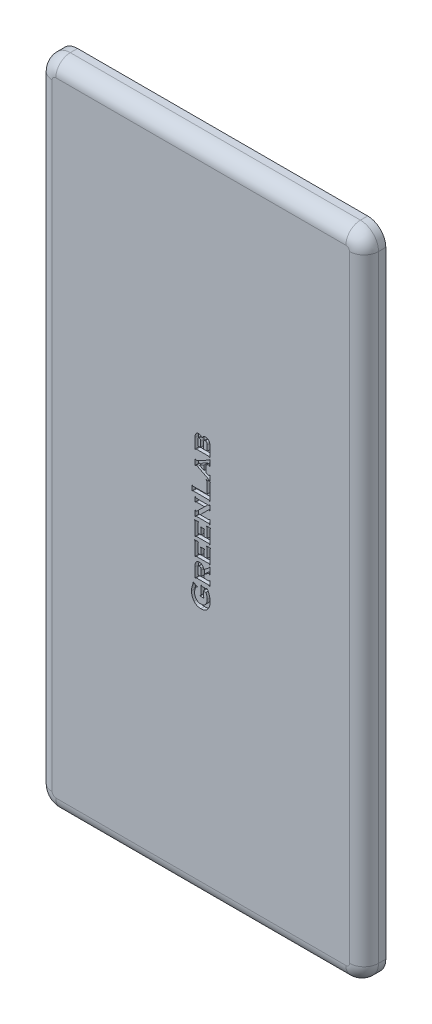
SolidWorks part; units mm, degrees
ref_plane "Front Plane" through (0, 0, 0) normal (0, 0, 1) x (1, 0, 0)
ref_plane "Top Plane" through (0, 0, 0) normal (0, 1, 0) x (1, 0, 0)
ref_plane "Right Plane" through (0, 0, 0) normal (1, 0, 0) x (0, 0, -1)
ref_plane "Plane1" through (0, 0, 3) normal (0, 0, 1) x (1, 0, 0)
sketch "Sketch1" plane through (0, 0, 3) normal (0, 0, 1) x (1, 0, 0)
  line L0 (-22.5, 67.5) -> (-22.5, -22.5)
  line L1 (-22.5, -22.5) -> (22.5, -22.5)
  line L2 (22.5, -22.5) -> (22.5, 67.5)
  line L3 (22.5, 67.5) -> (-22.5, 67.5)
  dimension "D1" = 45
  dimension "D2" = 90
extrude "Boss-Extrude1" add sketch "Sketch1" against normal blind 3
fillet "Fillet1" radius 2.5 4 edges at (-22.5, -22.5, 1.5) (-22.5, 67.5, 1.5) (22.5, -22.5, 1.5) (22.5, 67.5, 1.5)
fillet "Fillet2" radius 2 8 edges at (22.5, 22.5, 3) (21.7678, -21.7678, 3) (21.7678, 66.7678, 3) (0, -22.5, 3) (0, 67.5, 3) (-21.7678, -21.7678, 3) (-21.7678, 66.7678, 3) (-22.5, 22.5, 3)
sketch "Sketch2" plane through (0, 0, 3) normal (0, 0, 1) x (1, 0, 0)
  line L0 (1.25, 65.5) -> (1.25, -20.5) construction
  line L1 (20, 65.5) -> (-20, 65.5) construction
  line L2 (-20, -20.5) -> (20, -20.5) construction
  line L3 (22.5, 65) -> (22.5, -20) construction
  text T0 "GreenLab" font "Copperplate Gothic Bold" height 2.5
  dimension "D1" = 21.25
extrude "Cut-Extrude1" cut sketch "Sketch2" against normal blind 0.5
